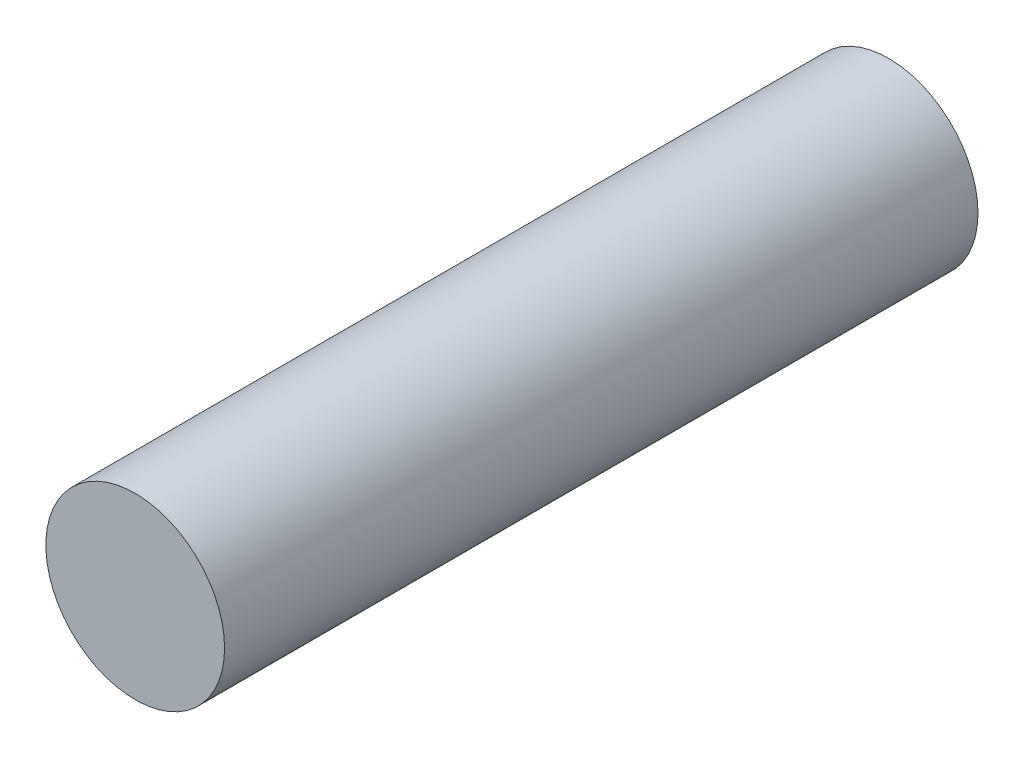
SolidWorks part; units mm, degrees
ref_plane "Front Plane" through (0, 0, 0) normal (0, 0, 1) x (1, 0, 0)
ref_plane "Top Plane" through (0, 0, 0) normal (0, 1, 0) x (1, 0, 0)
ref_plane "Right Plane" through (0, 0, 0) normal (1, 0, 0) x (0, 0, -1)
sketch "Sketch1" plane through (0, 0, 0) normal (0, 0, 1) x (1, 0, 0)
  circle A0 centre (0, 0) radius 0.6477
extrude "Boss-Extrude1" add sketch "Sketch1" along normal blind 5.461
